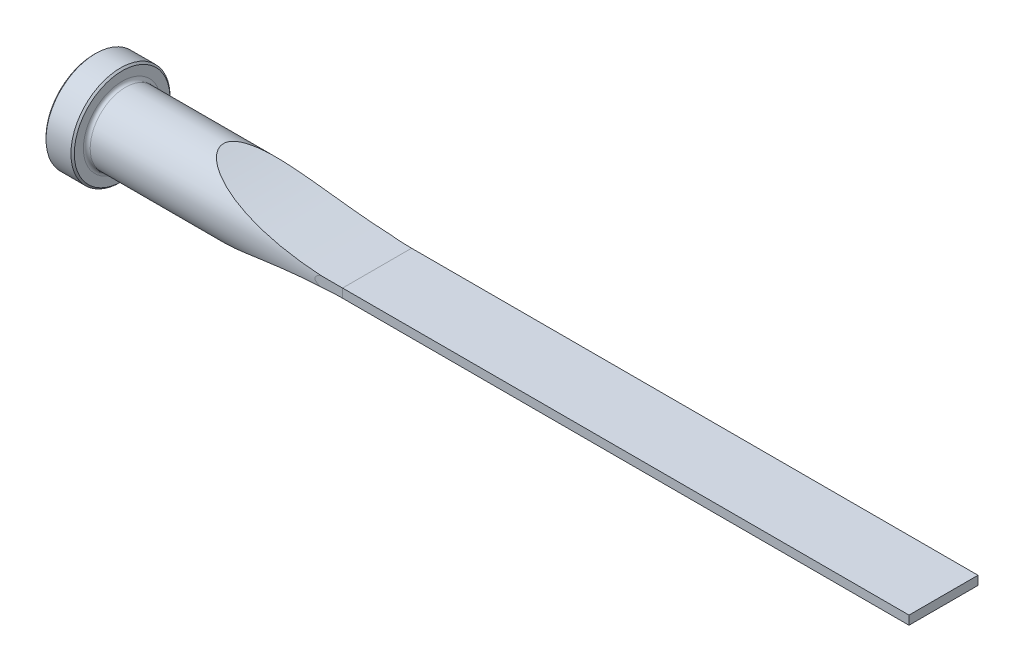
SolidWorks part; units mm, degrees
ref_plane "Front Plane" through (0, 0, 0) normal (0, 0, 1) x (1, 0, 0)
ref_plane "Top Plane" through (0, 0, 0) normal (0, 1, 0) x (1, 0, 0)
ref_plane "Right Plane" through (0, 0, 0) normal (1, 0, 0) x (0, 0, -1)
sketch "Sketch1" plane through (0, 0, 0) normal (0, 0, 1) x (1, 0, 0)
  line L0 (0, 0) -> (175.5286, 0) construction
  line L1 (0, 0) -> (0, 11.1125)
  line L2 (0, 11.1125) -> (6.35, 11.1125)
  line L3 (6.35, 11.1125) -> (6.35, 7.9375)
  line L4 (6.35, 7.9375) -> (190.5, 7.9375)
  line L5 (190.5, 7.9375) -> (190.5, 0)
  line L6 (190.5, 0) -> (0, 0)
  dimension "D1" = 190.5
  dimension "D2" = 22.225
  dimension "D3" = 15.875
  dimension "D4" = 6.35
revolve "Revolve1" add sketch "Sketch1" angle 360 about L0
sketch "Sketch2" plane through (0, 0, 0) normal (0, 0, 1) x (1, 0, 0)
  line L0 (190.5, 7.9375) -> (190.5, 0.9906)
  line L1 (190.5, -7.9375) -> (190.5, 7.9375) construction
  line L2 (190.5, 0.9906) -> (63.5, 0.9906)
  line L3 (190.5, 7.9375) -> (6.35, 7.9375) construction
  line L4 (29.0486, 7.9375) -> (190.5, 7.9375)
  line L5 (166.0833, 0) -> (153.1705, 0) construction
  arc A0 (63.5, 0.9906) -> (29.0486, 7.9375) centre (63.5, 89.8906) cw
  dimension "D1" = 88.9
  dimension "D3" = 127
  dimension "D2" = 1.9812
  dimension "D4" = 34.4514
extrude "Cut-Extrude1" cut sketch "Sketch2" against normal through all both and the other way through all
mirror "Mirror1" about plane through (0, 0, 0) normal (0, 1, 0) of "Cut-Extrude1"
sketch "Sketch3" plane through (0, 0, 0) normal (0, 1, 0) x (1, 0, 0)
  line L0 (190.5, 7.9375) -> (190.5, 7.7343)
  line L1 (190.5, 7.8754) -> (190.5, -7.8754) construction
  line L2 (190.5, 7.7343) -> (63.5, 7.7343)
  line L3 (190.5, 7.9375) -> (6.35, 7.9375) construction
  line L4 (57.4927, 7.9375) -> (190.5, 7.9375)
  line L5 (163.4716, 0) -> (166.2513, 0) construction
  line L6 (63.5, 7.8754) -> (63.5, -7.8754) construction
  arc A0 (63.5, 7.7343) -> (57.4927, 7.9375) centre (63.5, 96.6343) cw
  dimension "D2" = 88.9
  dimension "D1" = 15.4686
extrude "Cut-Extrude2" cut sketch "Sketch3" against normal through all both and the other way through all
mirror "Mirror2" about plane through (0, 0, 0) normal (0, 0, 1) of "Cut-Extrude2"
fillet "Fillet1" radius 0.762 1 edges at (6.35, 0, 7.9375)
chamfer "Chamfer1" distance 0.381 angle 45 2 edges at (0, 0, 11.1125) (6.35, 0, 11.1125)
